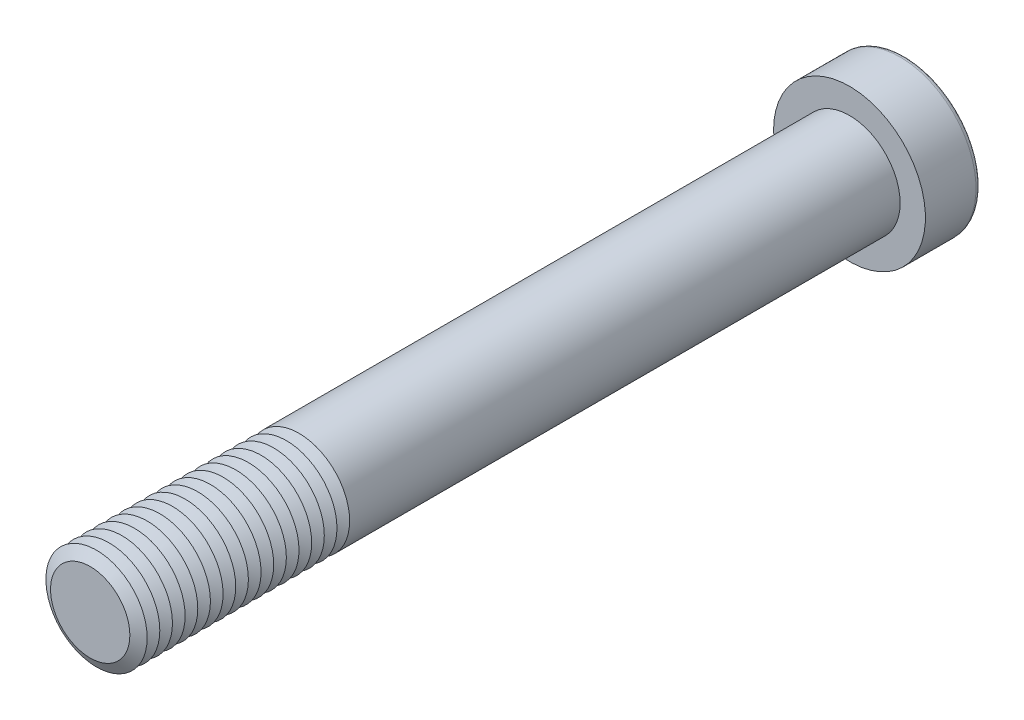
SolidWorks part; units mm, degrees
ref_plane "Front Plane" through (0, 0, 0) normal (0, 0, 1) x (1, 0, 0)
ref_plane "Top Plane" through (0, 0, 0) normal (0, 1, 0) x (1, 0, 0)
ref_plane "Right Plane" through (0, 0, 0) normal (1, 0, 0) x (0, 0, -1)
sketch "Sketch1" plane through (0, 0, 0) normal (0, 0, 1) x (1, 0, 0)
  circle A0 centre (0, 0) radius 10
  dimension "D1" = 20
extrude "Boss-Extrude1" add sketch "Sketch1" along normal blind 150
sketch "Sketch2" plane through (0, 0, 0) normal (0, 0, -1) x (-1, 0, 0)
  circle A0 centre (0, 0) radius 15
  dimension "D1" = 30
extrude "Boss-Extrude2" add sketch "Sketch2" along normal blind 11
sketch "Sketch3" plane through (0, 0, -11) normal (0, 0, -1) x (-1, 0, 0)
  line L1 (-4.0415, 7) -> (-8.0829, 0)
  line L2 (-8.0829, 0) -> (-4.0415, -7)
  line L3 (-4.0415, -7) -> (4.0415, -7)
  line L4 (4.0415, -7) -> (8.0829, 0)
  line L5 (8.0829, 0) -> (4.0415, 7)
  line L6 (4.0415, 7) -> (-4.0415, 7)
  circle A0 centre (0, 0) radius 7 construction
  dimension "D1" = 14
extrude "Cut-Extrude1" cut sketch "Sketch3" against normal blind 10.5
fillet "Fillet1" radius 1 1 edges at (-15, 0, -11)
sketch "Sketch4" plane through (0, 0, -0.5) normal (0, 0, -1) x (-1, 0, 0)
  line L0 (4.0415, -7) -> (8.0829, 0) construction
  circle A0 centre (0, 0) radius 7
extrude "Cut-Extrude2" cut sketch "Sketch4" against normal through all draft 60
sketch "Sketch5" plane through (0, 0, -11) normal (0, 0, -1) x (-1, 0, 0)
  circle A0 centre (0, 0) radius 8.0829
extrude "Cut-Extrude3" cut sketch "Sketch5" against normal through all draft 75
sketch "Sketch7" plane through (0, 0, 0) normal (1, 0, 0) x (0, 0, -1)
  line L25 (-150, 7.8349) -> (-148.75, 10)
  line L26 (-150, 10) -> (-150, -10) construction
  line L27 (-148.75, 10) -> (-151.25, 10)
  line L28 (-151.25, 10) -> (-150, 7.8349)
  line L29 (0, 10) -> (-150, 10) construction
  dimension "D1" = 2.5
revolve "Cut-Revolve1" cut sketch "Sketch7" angle 360 about axis through (0, 0, 150) along (0, 0, -1)
pattern_linear "LPattern1" count 17 spacing 2.5 along (0, 0, -1) of "Cut-Revolve1"
